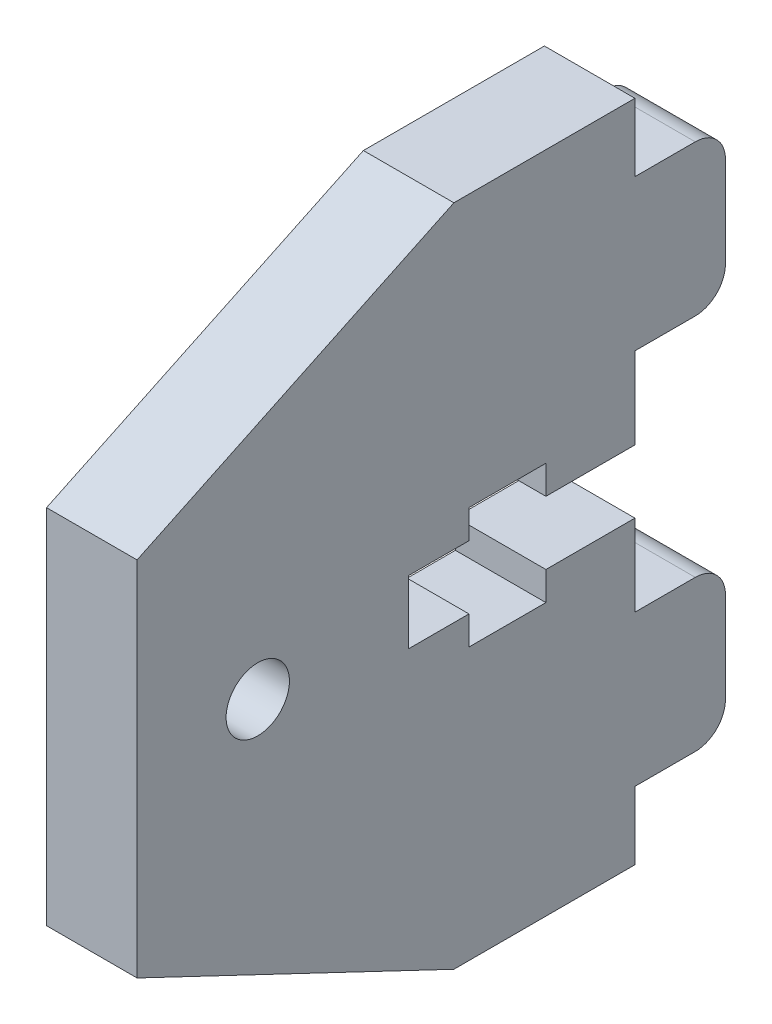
SolidWorks part; units mm, degrees
ref_plane "Спереди" through (0, 0, 0) normal (0, 0, 1) x (1, 0, 0)
ref_plane "Сверху" through (0, 0, 0) normal (0, 1, 0) x (1, 0, 0)
ref_plane "Справа" through (0, 0, 0) normal (1, 0, 0) x (0, 0, -1)
sketch "Эскиз1" plane through (0, 0, 0) normal (1, 0, 0) x (0, 0, -1)
  line L0 (-33, 22) -> (-41.1394, 22) construction
  line L1 (0, 0) -> (-33, 0)
  line L2 (0, 0) -> (0, 44)
  line L3 (0, 44) -> (-33, 44)
  line L4 (-33, 0) -> (-33, 44)
  line L5 (0, 39.5) -> (4, 39.5)
  line L6 (0, 39.5) -> (0, 29.5)
  line L7 (0, 29.5) -> (4, 29.5)
  line L8 (6, 37.5) -> (6, 31.5)
  line L9 (0, 14.5) -> (4, 14.5)
  line L10 (0, 14.5) -> (0, 4.5)
  line L11 (0, 4.5) -> (4, 4.5)
  line L12 (6, 12.5) -> (6, 6.5)
  line L13 (0, 24.1) -> (-15, 24.1)
  line L14 (0, 24.1) -> (0, 19.9)
  line L15 (0, 19.9) -> (-15, 19.9)
  line L16 (-15, 24.1) -> (-15, 19.9)
  line L17 (-11, 26) -> (-5.9, 26)
  line L18 (-11, 26) -> (-11, 18)
  line L19 (-11, 18) -> (-5.9, 18)
  line L20 (-5.9, 26) -> (-5.9, 18)
  line L21 (-33, 34) -> (-12, 44)
  line L22 (-33, 10) -> (-12, 0)
  circle A0 centre (-25, 22) radius 2.1
  arc A1 (4, 39.5) -> (6, 37.5) centre (4, 37.5) cw
  arc A2 (4, 29.5) -> (6, 31.5) centre (4, 31.5) ccw
  arc A3 (4, 14.5) -> (6, 12.5) centre (4, 12.5) cw
  arc A4 (4, 4.5) -> (6, 6.5) centre (4, 6.5) ccw
  point P21 (-15, 22)
  point P22 (-11, 22)
  point P25 (-12, 44)
  point P26 (-33, 34)
  point P35 (6, 39.5)
  point P38 (6, 29.5)
  point P41 (6, 14.5)
  point P44 (6, 4.5)
extrude "Бобышка-Вытянуть1" add sketch "Эскиз1" along normal blind 6 contours L7 A2 L8 A1 L5 L2 | L11 A4 L12 A3 L9 L2 | L4 L22 L1 L2 L15 L20 L19 L18 L16 L13 L17 L3 L21 A0
equation "\"D11@Эскиз1\"=\"D10@Эскиз1\"/2"
